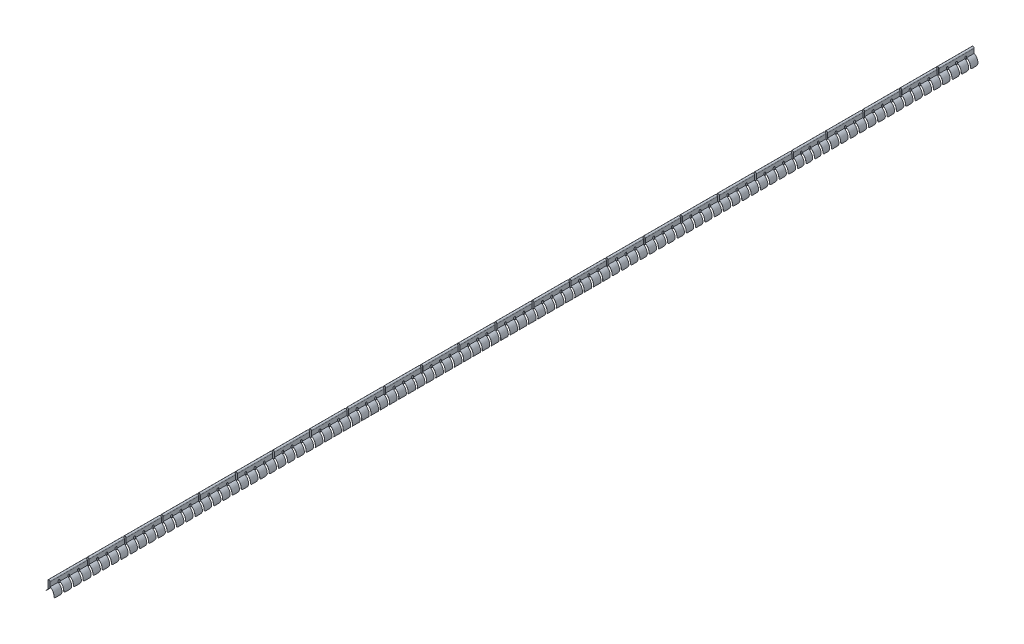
SolidWorks part; units mm, degrees
ref_plane "前视基准面" through (0, 0, 0) normal (0, 0, 1) x (1, 0, 0)
ref_plane "上视基准面" through (0, 0, 0) normal (0, 1, 0) x (1, 0, 0)
ref_plane "右视基准面" through (0, 0, 0) normal (1, 0, 0) x (0, 0, -1)
imported_body "1008050-104TE-EK盖板屏蔽簧-1-solid1"
imported_body "1008050-42TE-EK盖板屏蔽簧-2-solid1"
sketch "草图1" plane through (-170.7861, 0, 0) normal (1, 0, 0) x (0, 0, -1)
  line L5 (-92.5276, 47.2074) -> (27.5323, 47.2074)
  line L6 (-92.5276, 47.2074) -> (-92.5276, 8.3089)
  line L7 (-92.5276, 8.3089) -> (27.5323, 8.3089)
  line L8 (27.5323, 47.2074) -> (27.5323, 8.3089)
extrude "切除-拉伸1" cut sketch "草图1" against normal mid plane 10
